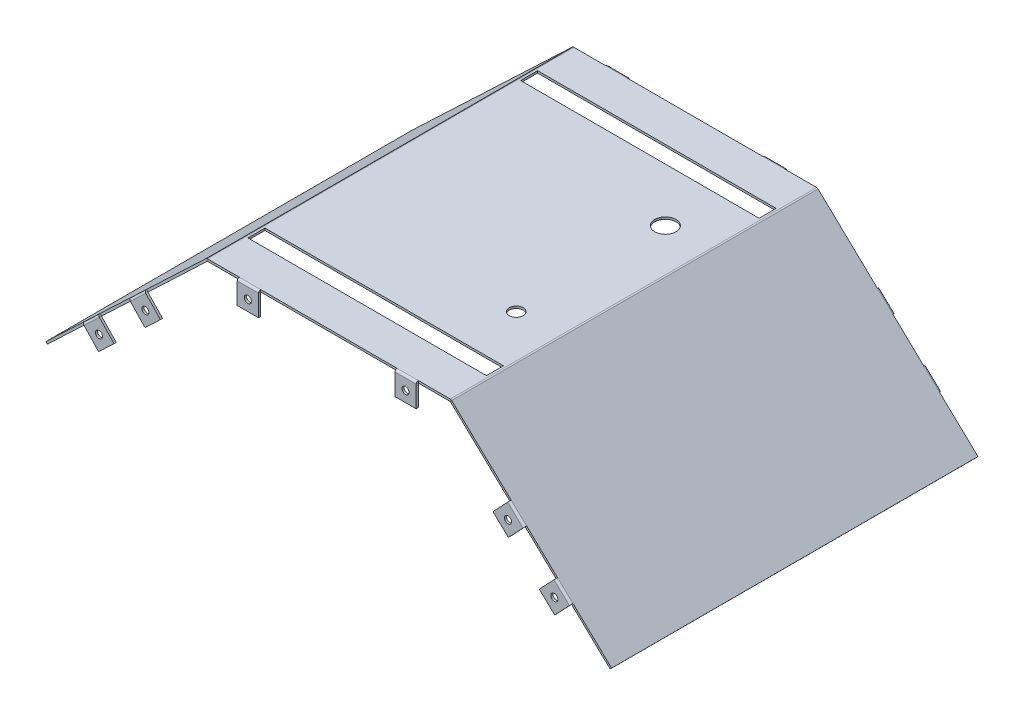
SolidWorks part; units mm, degrees
ref_plane "Front Plane" through (0, 0, 0) normal (0, 0, 1) x (1, 0, 0)
ref_plane "Top Plane" through (0, 0, 0) normal (0, 1, 0) x (1, 0, 0)
ref_plane "Right Plane" through (0, 0, 0) normal (1, 0, 0) x (0, 0, -1)
sketch "Sketch1" plane through (0, 0, 0) normal (0, 1, 0) x (1, 0, 0)
  line L0 (-38.5, 182) -> (-48.5, 182)
  line L1 (0, 0) -> (15, 0)
  line L2 (0, 0) -> (0, 172) construction
  line L3 (0, 172) -> (15, 172)
  line L4 (114, 0) -> (114, 172) construction
  line L5 (114, 0) -> (152.5, 0)
  line L6 (15, 182) -> (25, 182)
  line L7 (114, 172) -> (152.5, 172)
  line L8 (217.5, 0) -> (217.5, 172)
  line L9 (0, 0) -> (-38.5, 0)
  line L10 (152.5, 182) -> (162.5, 182)
  line L11 (0, 172) -> (-38.5, 172)
  line L12 (-103.5, 0) -> (-103.5, 172)
  line L13 (-38.5, -10) -> (-48.5, -10)
  line L14 (15, -10) -> (25, -10)
  line L15 (152.5, -10) -> (162.5, -10)
  line L16 (0, 177) -> (-103.5, 177) construction
  line L17 (0, 177) -> (114, 177) construction
  line L18 (114, 177) -> (217.5, 177) construction
  line L19 (0, -5) -> (-103.5, -5) construction
  line L20 (0, -5) -> (114, -5) construction
  line L21 (114, -5) -> (217.5, -5) construction
  line L22 (-78.5, 182) -> (-78.5, 172)
  line L23 (-68.5, 182) -> (-68.5, 172)
  line L24 (-48.5, 182) -> (-48.5, 172)
  line L25 (-38.5, 182) -> (-38.5, 172)
  line L26 (15, 182) -> (15, 172)
  line L27 (25, 182) -> (25, 172)
  line L28 (89, 182) -> (89, 172)
  line L29 (99, 182) -> (99, 172)
  line L30 (152.5, 182) -> (152.5, 172)
  line L31 (162.5, 182) -> (162.5, 172)
  line L32 (182.5, 182) -> (182.5, 172)
  line L33 (192.5, 182) -> (192.5, 172)
  line L34 (-78.5, 0) -> (-78.5, -10)
  line L35 (-68.5, -10) -> (-68.5, 0)
  line L36 (-48.5, -10) -> (-48.5, 0)
  line L37 (-38.5, -10) -> (-38.5, 0)
  line L38 (15, -10) -> (15, 0)
  line L39 (25, -10) -> (25, 0)
  line L40 (89, -10) -> (89, 0)
  line L41 (99, -10) -> (99, 0)
  line L42 (152.5, -10) -> (152.5, 0)
  line L43 (162.5, -10) -> (162.5, 0)
  line L44 (182.5, -10) -> (182.5, 0)
  line L45 (192.5, -10) -> (192.5, 0)
  line L46 (0, 182) -> (-103.5, 182) construction
  line L47 (-78.5, 172) -> (-103.5, 172)
  line L48 (0, 172) -> (-103.5, 172) construction
  line L49 (-68.5, 182) -> (-78.5, 182)
  line L50 (-48.5, 172) -> (-68.5, 172)
  line L51 (0, 182) -> (114, 182) construction
  line L52 (25, 172) -> (89, 172)
  line L53 (0, 172) -> (114, 172) construction
  line L54 (89, 182) -> (99, 182)
  line L55 (99, 172) -> (114, 172)
  line L56 (114, 182) -> (217.5, 182) construction
  line L57 (182.5, 182) -> (192.5, 182)
  line L58 (192.5, 172) -> (217.5, 172)
  line L59 (114, 172) -> (217.5, 172) construction
  line L60 (162.5, 172) -> (182.5, 172)
  line L61 (114, -10) -> (217.5, -10) construction
  line L62 (192.5, 0) -> (217.5, 0)
  line L63 (114, 0) -> (217.5, 0) construction
  line L64 (162.5, 0) -> (182.5, 0)
  line L65 (0, -10) -> (114, -10) construction
  line L66 (99, 0) -> (114, 0)
  line L67 (0, 0) -> (114, 0) construction
  line L68 (89, -10) -> (99, -10)
  line L69 (25, 0) -> (89, 0)
  line L70 (-48.5, 0) -> (-68.5, 0)
  line L71 (0, 0) -> (-103.5, 0) construction
  line L72 (-78.5, 0) -> (-103.5, 0)
  line L73 (0, -10) -> (-103.5, -10) construction
  line L74 (-68.5, -10) -> (-78.5, -10)
  line L75 (182.5, -10) -> (192.5, -10)
  line L76 (94, 121) -> (94, 51) construction
  line L77 (114, 86) -> (0, 86) construction
  line L78 (1, 26) -> (1, 18)
  line L79 (1, 146) -> (113, 146)
  line L80 (113, 26) -> (113, 18)
  line L81 (1, 154) -> (113, 154)
  line L82 (1, 154) -> (1, 146)
  line L83 (1, 26) -> (113, 26)
  line L84 (113, 154) -> (113, 146)
  line L85 (1, 18) -> (113, 18)
  circle A0 centre (-73.5, 177) radius 1.65
  circle A1 centre (-43.5, 177) radius 1.65
  circle A2 centre (20, 177) radius 1.65
  circle A3 centre (94, 177) radius 1.65
  circle A4 centre (157.5, 177) radius 1.65
  circle A5 centre (187.5, 177) radius 1.65
  circle A6 centre (-73.5, -5) radius 1.65
  circle A7 centre (-43.5, -5) radius 1.65
  circle A8 centre (20, -5) radius 1.65
  circle A9 centre (94, -5) radius 1.65
  circle A10 centre (157.5, -5) radius 1.65
  circle A11 centre (187.5, -5) radius 1.65
  circle A12 centre (94, 121) radius 5
  circle A13 centre (94, 51) radius 3.25
  dimension "D8" = 3.3
  dimension "D14" = 20
  dimension "D15" = 20
  dimension "D16" = 20
  dimension "D17" = 20
  dimension "D18" = 30
  dimension "D19" = 60
  dimension "D20" = 30
  dimension "D21" = 60
  dimension "D22" = 30
  dimension "D23" = 60
  dimension "D24" = 30
  dimension "D42" = 10
  dimension "D43" = 6.5
  dimension "D44" = 35
  dimension "D45" = 35
  dimension "D1" = 114
  dimension "D2" = 103.5
  dimension "D3" = 103.5
  dimension "D4" = 172
  dimension "D5" = 5
  dimension "D6" = 5
  dimension "D9" = 5
  dimension "D11" = 5
  dimension "D12" = 5
  dimension "D13" = 5
  dimension "D25" = 60
  dimension "D26" = 5
  dimension "D27" = 10
  dimension "D28" = 5
  dimension "D29" = 5
  dimension "D30" = 5
  dimension "D31" = 5
  dimension "D32" = 5
  dimension "D33" = 5
  dimension "D34" = 5
  dimension "D35" = 5
  dimension "D36" = 5
  dimension "D37" = 5
  dimension "D38" = 5
  dimension "D39" = 5
  dimension "D40" = 5
  dimension "D41" = 5
  dimension "D46" = 20
  dimension "D47" = 8
  dimension "D48" = 18
  dimension "D49" = 18
  dimension "D50" = 8
  dimension "D51" = 1
  dimension "D52" = 1
  dimension "D53" = 1
  dimension "D54" = 1
  dimension "D7" = 10
  dimension "D10" = 10
sheet metal parameters "Sheet-Metal1" thickness 1 parameters "D1"=0.0001
base flange "Base-Flange1" sketch "Sketch1" thickness 1 reverse thickness direction yes parameters "D1"=0.0001
sketch "Sketch3" plane through (0, 1, 0) normal (0, 1, 0) x (1, 0, 0)
  line L0 (114, 172) -> (114, 0)
  line L1 (15, 172) -> (-38.5, 172) construction
  line L2 (-38.5, 0) -> (15, 0) construction
  line L3 (0, 172) -> (0, 0)
  line L4 (217.5, 0) -> (217.5, 172) construction
  line L5 (-103.5, 172) -> (-103.5, 0) construction
  dimension "D1" = 103.5
  dimension "D2" = 103.5
sketched bend "Sketched Bend6" parameters "D1"=0.001
bend "SketchBend11" bend radius 0.001 bend angle 43.5 parameters "D5"=1
bend "SketchBend12" bend radius 0.001 bend angle 43.5 parameters "D5"=2
sketch "Sketch4" plane through (0, 1, 0) normal (0, 1, 0) x (1, 0, 0)
  line L0 (15, 0) -> (25, 0)
  line L1 (89, 0) -> (99, 0)
  line L2 (15, 172) -> (25, 172)
  line L3 (89, 172) -> (99, 172)
sketched bend "Sketched Bend12" parameters "D1"=0
bend "SketchBend18" bend radius 0 bend angle 90 parameters "D5"=3
bend "SketchBend19" bend radius 0 bend angle 90 parameters "D5"=4
sketch "Sketch5" plane through (54.7052, 57.6473, 0) normal (0.6884, 0.7254, 0) x (0.7254, -0.6884, 0)
  line L0 (121.1927, 172) -> (161.1927, 172)
  line L1 (121.1927, 0) -> (161.1927, 0)
sketched bend "Sketched Bend13" parameters "D1"=0
bend "SketchBend20" bend radius 0.0001 bend angle 90 parameters "D5"=5
bend "SketchBend21" bend radius 0 bend angle 90 parameters "D5"=6
sketch "Sketch6" plane through (-0.6884, 0.7254, 0) normal (-0.6884, 0.7254, 0) x (0.7254, 0.6884, 0)
  line L0 (-78.5, 172) -> (-38.5, 172)
  line L1 (-38.5, 172) -> (-38.5, 182) construction
  line L2 (-78.5, 0) -> (-38.5, 0)
sketched bend "Sketched Bend14" parameters "D1"=0
bend "SketchBend22" bend radius 0.0001 bend angle 90 parameters "D5"=7
bend "SketchBend23" bend radius 0 bend angle 90 parameters "D5"=8
flat pattern "Flat-Pattern1"
sketch "Bend-Lines1" plane through (0, 0, 0) normal (0, 1, 0) x (-1, 0, 0)
bend of the flat pattern "Flatten-<SketchBend11>1"
bend of the flat pattern "Flatten-<SketchBend12>1"
bend of the flat pattern "Flatten-<SketchBend18>1"
bend of the flat pattern "Flatten-<SketchBend19>1"
bend of the flat pattern "Flatten-<SketchBend20>1"
bend of the flat pattern "Flatten-<SketchBend21>1"
bend of the flat pattern "Flatten-<SketchBend22>1"
bend of the flat pattern "Flatten-<SketchBend23>1"
